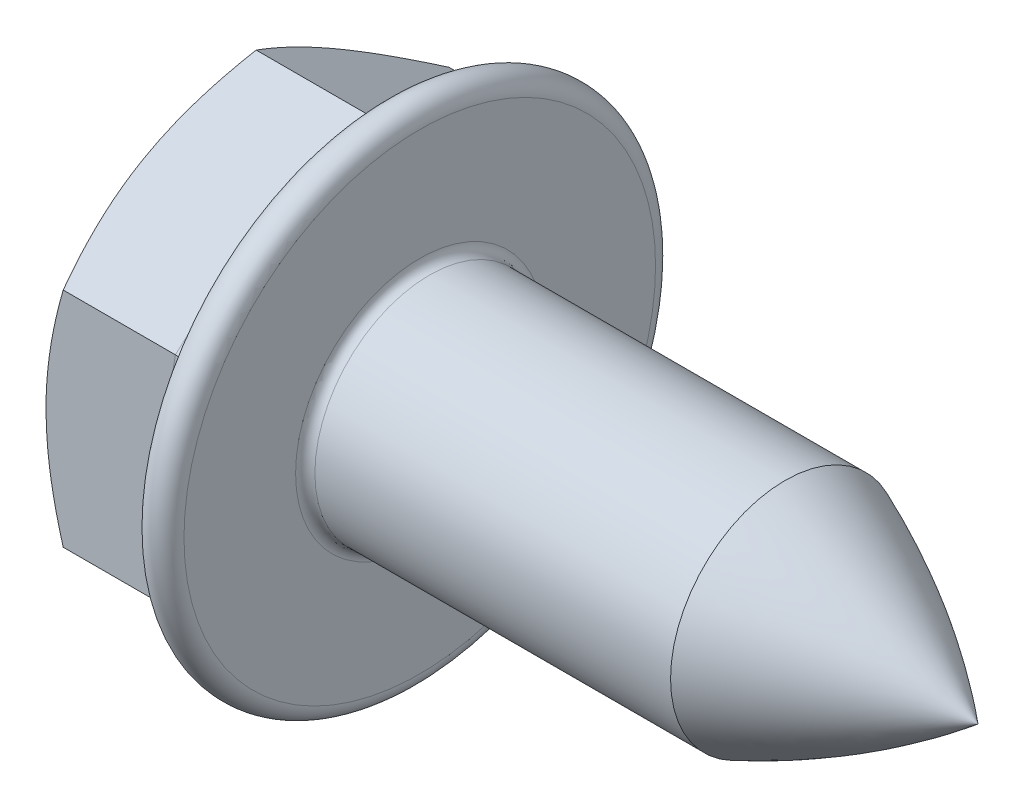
SolidWorks part; units mm, degrees
ref_plane "Front" through (0, 0, 0) normal (0, 0, 1) x (1, 0, 0)
ref_plane "Top" through (0, 0, 0) normal (0, 1, 0) x (1, 0, 0)
ref_plane "Right" through (0, 0, 0) normal (1, 0, 0) x (0, 0, -1)
sketch "Sketch2" plane through (0, 0, 0) normal (1, 0, 0) x (0, 0, -1)
  line L1 (0, 9.2376) -> (-8, 4.6188)
  line L2 (-8, 4.6188) -> (-8, -4.6188)
  line L3 (-8, -4.6188) -> (0, -9.2376)
  line L4 (0, -9.2376) -> (8, -4.6188)
  line L5 (8, -4.6188) -> (8, 4.6188)
  line L6 (8, 4.6188) -> (0, 9.2376)
  circle A0 centre (0, 0) radius 8 construction
  dimension "s" = 16
extrude "BaseHead" add sketch "Sketch2" along normal blind 7.5
sketch "Sketch1" plane through (0, 0, 0) normal (0, 0, 1) x (1, 0, 0)
  line L0 (-9.5445, 0) -> (41.9665, 0) construction
  line L1 (30.65, 0) -> (30.65, 4.75)
  line L2 (30.65, 4.75) -> (7.5, 4.75)
  line L3 (7.5, 4.75) -> (7.5, 0)
  line L4 (30.65, 0) -> (7.5, 0)
  line L5 (7.5, 4.6188) -> (7.5, -4.6188) construction
  line L6 (9.6, 9.2774) -> (9.6, -3.0979) construction
  dimension "st" = 9.5
  dimension "l" = 23.15
  dimension "a" = 2.1
revolve "BaseBody" add sketch "Sketch1" angle 360 about L0
sketch "Sketch3" plane through (0, 0, 0) normal (0, 0, 1) x (1, 0, 0)
  line L0 (-1.5622, 0) -> (12.5659, 0) construction
  line L2 (7.5, 0) -> (7.5, 9.7782)
  line L3 (6.1, 10.0251) -> (2.4512, 0)
  line L4 (2.4512, 0) -> (7.5, 0)
  line L5 (7.5, 4.6188) -> (7.5, -4.6188) construction
  arc A0 (7.5, 9.7782) -> (6.1, 10.0251) centre (6.7782, 9.7782) ccw
  dimension "dc" = 21
  dimension "D2" = 70
  dimension "c" = 1.4
revolve "Neck" add sketch "Sketch3" angle 360 about L0
sketch "Sketch4" plane through (0, 0, 0) normal (0, 0, 1) x (1, 0, 0)
  line L0 (10.6638, 0) -> (-1.5125, 0) construction
  line L2 (0, 8) -> (0.7145, 9.2376)
  line L5 (0.7145, 9.2376) -> (0, 9.2376)
  line L6 (0, 9.2376) -> (0, 8)
  dimension "D1" = 16
  dimension "D2" = 30
revolve "Cut-Revolve7" cut sketch "Sketch4" angle 360 about L0
fillet "Fillet1" radius 0.4 1 edges at (7.5, 0, 4.75)
fillet "Fillet2" radius 0.6 6 edges
sketch "Sketch5" plane through (0, 0, 0) normal (0, 0, 1) x (1, 0, 0)
  line L0 (31.9782, 0) -> (17.0112, 0) construction
  line L2 (26.45, -4.75) -> (28.55, -4.75)
  line L3 (28.55, -4.75) -> (30.65, -4.225)
  line L5 (30.65, -4.75) -> (30.65, 4.75) construction
  line L6 (26.45, -4.75) -> (26.45, -5.25)
  line L7 (26.45, -5.25) -> (30.65, -5.25)
  line L8 (30.65, -5.25) -> (30.65, -4.225)
  point P15 (28.55, -4.75)
  dimension "D1" = 9.5
  dimension "yf" = 4.2
  dimension "D2" = 2.1
  dimension "D3" = 0.525
  dimension "D4" = 0.5
revolve "Cut-Revolve1" cut sketch "Sketch5" angle 360 about L0
sketch "Sketch6" plane through (0, 0, 0) normal (0, 0, 1) x (1, 0, 0)
  line L0 (33.3907, 0) -> (10.0621, 0) construction
  line L2 (30.65, -4.75) -> (30.65, 4.75) construction
  line L3 (30.65, 0) -> (22.65, -4.75) construction
  line L6 (30.65, 0) -> (31.15, 0)
  line L7 (22.65, -4.75) -> (30.65, -4.75)
  line L8 (31.15, 0) -> (31.15, -4.75)
  line L9 (31.15, -4.75) -> (30.65, -4.75)
  arc A0 (30.65, 0) -> (22.65, -4.75) centre (10.4863, 24.8481) cw
  dimension "D1" = 32
  dimension "D2" = 0.5
  dimension "yc" = 8
  dimension "D3" = 9.5
revolve "Cut-Revolve6" cut sketch "Sketch6" angle 360 about L0
sketch "Sketch7" plane through (0, 0, 0) normal (0, 0, 1) x (1, 0, 0)
  line L0 (0, 0) -> (-5.0817, 0) construction
  line L1 (-0.5, 6.6667) -> (1.0417, 6.6667)
  line L2 (-0.5, 6.6667) -> (-0.5, 0)
  line L3 (-0.5, 0) -> (1.25, 0)
  line L4 (1.25, 6.4583) -> (1.25, 0)
  arc A0 (1.0417, 6.6667) -> (1.25, 6.4583) centre (1.0417, 6.4583) cw
  point P9 (1.25, 6.6667)
  dimension "D4" = 0.2083
  dimension "D1" = 0.5
  dimension "D2" = 1.25
  dimension "D3" = 13.3333
revolve "Cut-Revolve8" cut sketch "Sketch7" angle 360 about L0
sketch "Sketch8" plane through (0, 0, 0) normal (0, 0, 1) x (1, 0, 0)
  line L0 (9.35, 5.25) -> (9.85, 5.25)
  line L1 (9.85, 5.25) -> (9.85, 4.75)
  line L2 (9.85, 4.75) -> (9.6, 4.317)
  line L3 (9.6, 4.317) -> (9.35, 4.75)
  line L4 (9.35, 4.75) -> (9.35, 5.25)
  line L5 (0, 0) -> (-6.1497, 0) construction
  line L6 (7.5, -9.7782) -> (7.5, 9.7782) construction
  dimension "D1" = 9.5
  dimension "D2" = 0.5
  dimension "D3" = 2.1
revolve "Cut-Revolve10" [suppressed] cut sketch "Sketch8" angle 360 about L5
pattern_linear "LPattern10" [suppressed] count 35 spacing 0.6 along (1, 0, 0)
equation "\"D3@Sketch5\" = \"yf@Sketch5\" / 8"
equation "\"D2@ThreadCosmetic1\" = \"st@Sketch1\" - 1"
equation "\"D1@Sketch6\" = \"yc@Sketch6\" * 4"
equation "\"D3@Sketch6\" = \"st@Sketch1\""
equation "\"D2@Sketch5\" = \"yf@Sketch5\" / 2"
equation "\"D1@Sketch4\" = \"s@Sketch2\""
equation "\"D1@Sketch5\" = \"st@Sketch1\""
equation "\"D1@ThreadCosmetic1\" = \"l@Sketch1\" - \"a@Sketch1\""
equation "\"D2@Sketch7\" = \"k@BaseHead\" / 6"
equation "\"D3@Sketch7\" = \"s@Sketch2\" * 5 / 6"
equation "\"D4@Sketch7\" = \"D2@Sketch7\" / 6"
equation "\"D1@Sketch8\" = \"st@Sketch1\""
equation "\"D2@Sketch8\" = (  \"st@Sketch1\" - \"D2@ThreadCosmetic1\" )  / 2"
equation "\"D3@Sketch8\" = \"a@Sketch1\""
equation "\"D3@LPattern10\" = \"D2@Sketch8\" * 1.2"
equation "\"D1@LPattern10\" = \"D1@ThreadCosmetic1\" / \"D3@LPattern10\""
